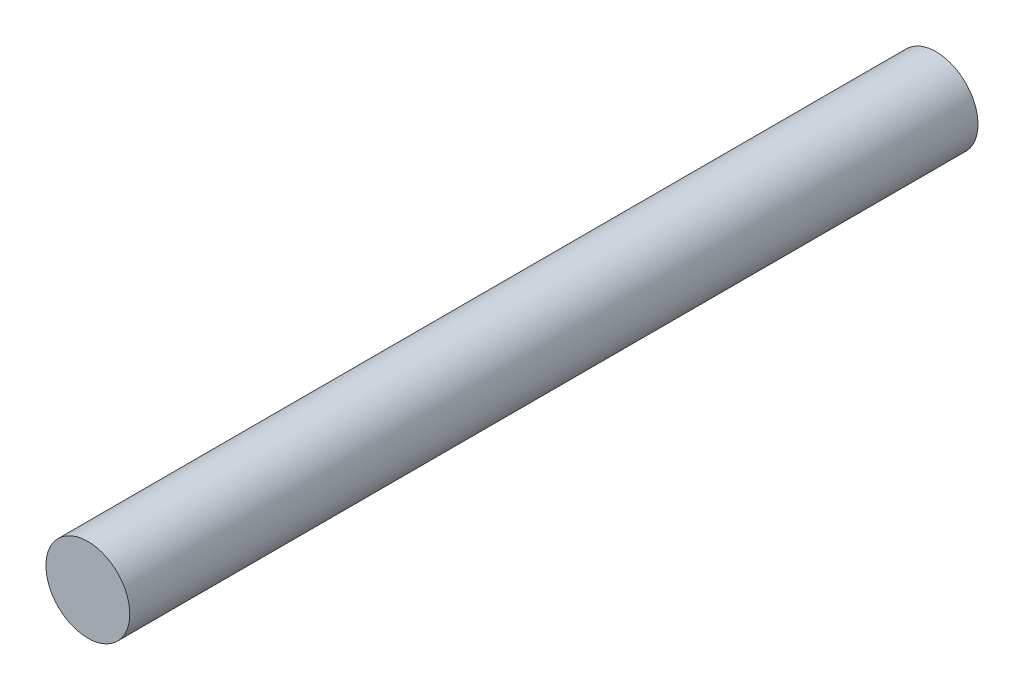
SolidWorks part; units mm, degrees
ref_plane "Front" through (0, 0, 0) normal (0, 0, 1) x (1, 0, 0)
ref_plane "Top" through (0, 0, 0) normal (0, 1, 0) x (1, 0, 0)
ref_plane "Right" through (0, 0, 0) normal (1, 0, 0) x (0, 0, -1)
sketch "Sketch1" plane through (0, 0, 0) normal (0, 0, 1) x (1, 0, 0)
  circle A0 centre (0, 0) radius 2.8829
extrude "Extrude1" add sketch "Sketch1" along normal blind 58.3184
